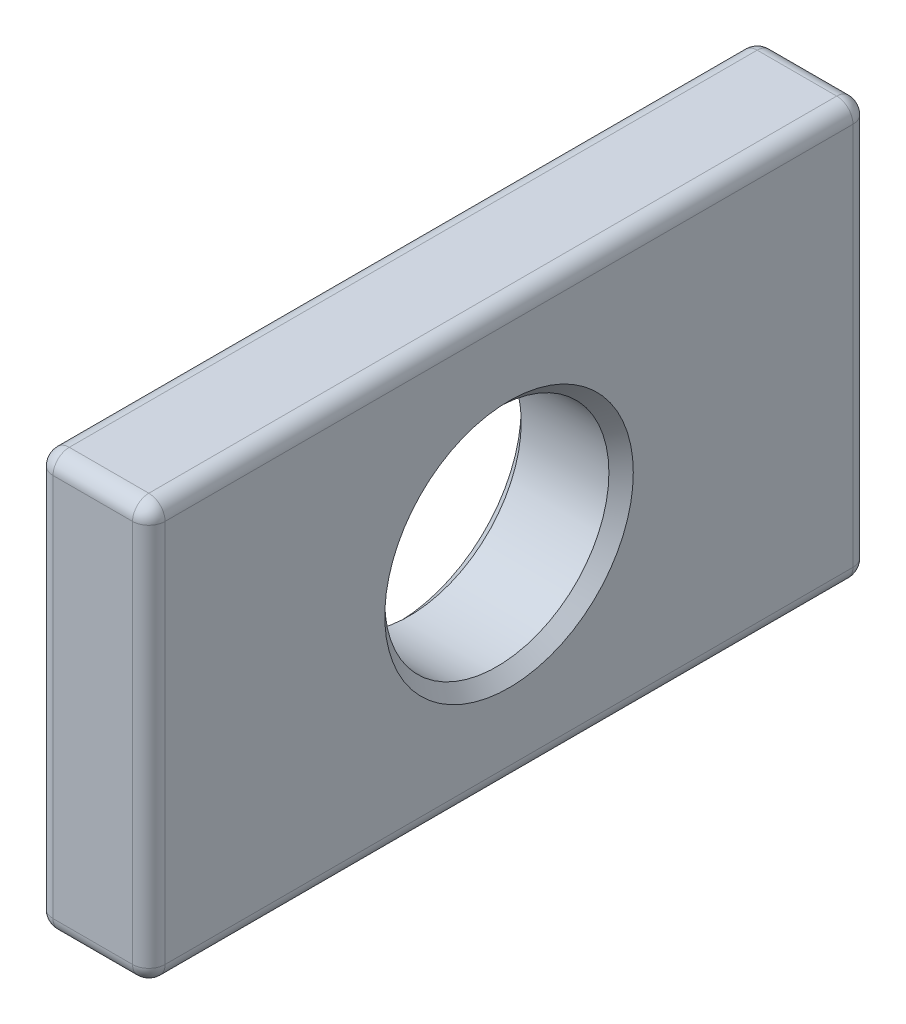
SolidWorks part; units mm, degrees
ref_plane "Front Plane" through (0, 0, 0) normal (0, 0, 1) x (1, 0, 0)
ref_plane "Top Plane" through (0, 0, 0) normal (0, 1, 0) x (1, 0, 0)
ref_plane "Right Plane" through (0, 0, 0) normal (1, 0, 0) x (0, 0, -1)
sketch "Sketch1" plane through (0, 0, 0) normal (1, 0, 0) x (0, 0, -1)
  line L1 (-22.5, 13) -> (22.5, 13)
  line L2 (-22.5, 13) -> (-22.5, -13)
  line L3 (-22.5, -13) -> (22.5, -13)
  line L4 (22.5, 13) -> (22.5, -13)
  line L5 (-22.5, 13) -> (22.5, -13) construction
  line L6 (-22.5, -13) -> (22.5, 13) construction
  circle A0 centre (0, 0) radius 7
  point P0 (0, 0)
  dimension "D3" = 14
  dimension "D1" = 26
  dimension "D2" = 45
extrude "Boss-Extrude1" add sketch "Sketch1" along normal mid plane 7
fillet "Fillet1" radius 1.016 12 edges at (0, -13, -22.5) (0, 13, -22.5) (-3.5, 13, 0) (-3.5, -13, 0) (-3.5, 0, -22.5) (0, 13, 22.5) (0, -13, 22.5) (-3.5, 0, 22.5) (3.5, -13, 0) (3.5, 0, 22.5) (3.5, 13, 0) (3.5, 0, -22.5)
chamfer "Chamfer1" distance 0.762 angle 45 2 edges at (-3.5, 0, -7) (3.5, 0, -7)
